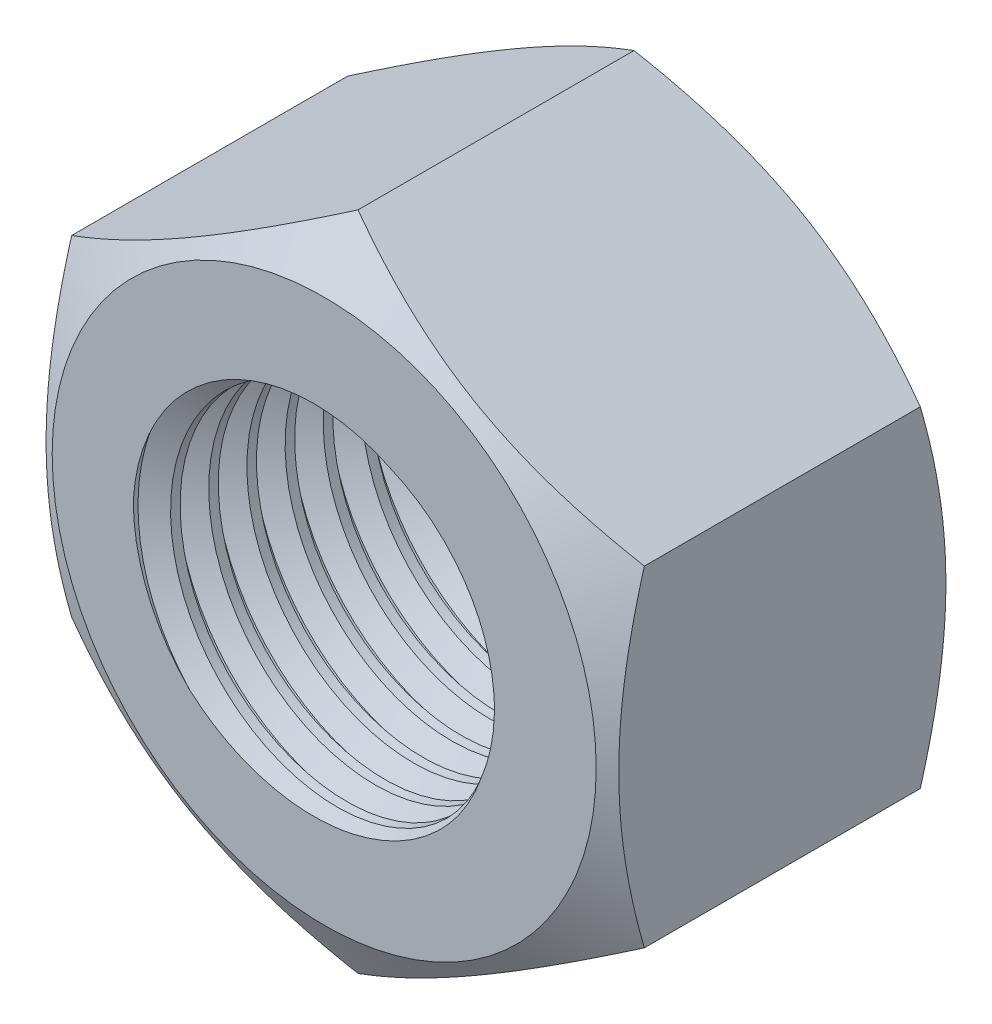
SolidWorks part; units mm, degrees
ref_plane "Płaszczyzna przednia" through (0, 0, 0) normal (0, 0, 1) x (1, 0, 0)
ref_plane "Płaszczyzna górna" through (0, 0, 0) normal (0, 1, 0) x (1, 0, 0)
ref_plane "Płaszczyzna prawa" through (0, 0, 0) normal (1, 0, 0) x (0, 0, -1)
sketch "Szkic1" plane through (0, 0, 0) normal (0, 0, 1) x (1, 0, 0)
  line L7 (0, 17.3205) -> (-15, 8.6603)
  line L8 (-15, 8.6603) -> (-15, -8.6603)
  line L9 (-15, -8.6603) -> (0, -17.3205)
  line L10 (0, -17.3205) -> (15, -8.6603)
  line L11 (15, -8.6603) -> (15, 8.6603)
  line L12 (15, 8.6603) -> (0, 17.3205)
  circle A0 centre (0, 0) radius 15 construction
  circle A2 centre (0, 0) radius 10
  dimension "D2" = 20
  dimension "D1" = 30
extrude "Dodanie-wyciągnięcie1" add sketch "Szkic1" along normal mid plane 18
sketch "Szkic2" plane through (0, 0, 9) normal (0, 0, 1) x (1, 0, 0)
  circle A0 centre (0, 0) radius 14.25
  dimension "D1" = 28.5
extrude "Wytnij-wyciągnięcie1" cut sketch "Szkic2" against normal through all draft 60 flip side to cut
mirror "Lustro1" about plane through (0, 0, 0) normal (0, 0, 1) of "Wytnij-wyciągnięcie1"
thread "Gwint1" pitch 2 start angle 0, offset 5, length 0, pitch 2, diameter 20
ref_plane "Płaszczyzna1" through (10, 0, -14) normal (0, -1, 0) x (1, 0, 0)
sketch "Profil gwintu1" plane through (10, 0, -14) normal (0, -1, 0) x (1, 0, 0)
  line L0 (0, 0) -> (0, 2) construction
  line L11 (0, 0) -> (0, 1.75)
  line L12 (0, 1.75) -> (-1.0825, 1.125)
  line L13 (-1.0825, 1.125) -> (-1.0825, 0.625)
  line L15 (-1.0825, 0.625) -> (0, 0)
  line L17 (-1.0825, 0.875) -> (0, 0.875) construction
  point P2 (0, 0)
  dimension "Pitch" = 2
  dimension "Profile_Angle" = 60
  dimension "Profile_Land" = 0.5
  dimension "Profile_Height" = 1.0825
ref_plane "Płaszczyzna2" through (0, 0, -9) normal (0, 0, -1) x (-1, 0, 0)
other "Cięcie powierzchnią1"
ref_plane "Płaszczyzna3" through (0, 0, 9) normal (0, 0, 1) x (1, 0, 0)
other "Cięcie powierzchnią2"
